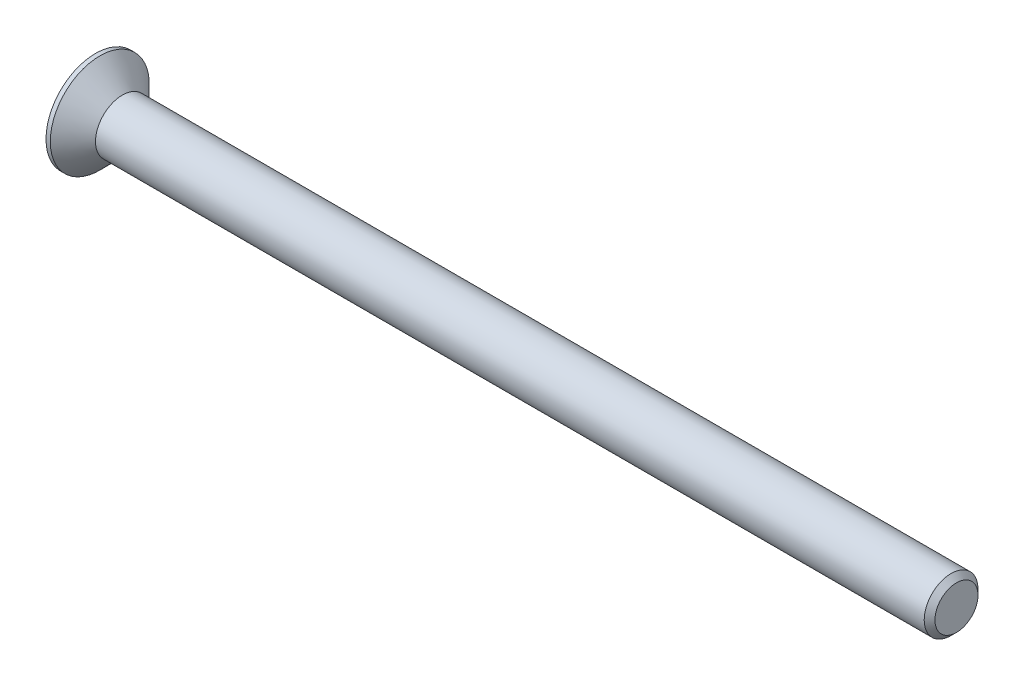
SolidWorks part; units mm, degrees
ref_plane "Front Plane" through (0, 0, 0) normal (0, 0, 1) x (1, 0, 0)
ref_plane "Top Plane" through (0, 0, 0) normal (0, 1, 0) x (1, 0, 0)
ref_plane "Right Plane" through (0, 0, 0) normal (1, 0, 0) x (0, 0, -1)
sketch "Sketch1" plane through (0, 0, 0) normal (0, 0, 1) x (1, 0, 0)
  line L1 (-2.5, 4.6) -> (-2.5, 0)
  line L2 (-2.5, 0) -> (77.5, 0)
  line L3 (77.5, 0) -> (77.5, 2.5)
  line L4 (77.5, 2.5) -> (0, 2.5)
  line L5 (-2.5, 4.6) -> (-2.1, 4.6)
  line L6 (-2.1, 4.6) -> (0, 2.5)
  dimension "D1" = 2.5
  dimension "D2" = 45
  dimension "D3" = 2.5
  dimension "D4" = 80
  dimension "D5" = 4.6
revolve "Revolve1" add sketch "Sketch1" angle 360 about L2
chamfer "Chamfer1" distance 0.5 angle 45 1 edges at (77.5, 0, 2.5)
sketch "Sketch2" plane through (-2.5, 0, 0) normal (-1, 0, 0) x (0, 0, 1)
  line L0 (-0.575, 2.3) -> (0.575, 2.3)
  line L1 (0.575, 2.3) -> (0.575, 0.575)
  line L2 (0.575, 0.575) -> (2.3, 0.575)
  line L3 (2.3, 0.575) -> (2.3, -0.575)
  line L4 (2.3, -0.575) -> (0.575, -0.575)
  line L5 (0.575, -0.575) -> (0.575, -2.3)
  line L6 (0.575, -2.3) -> (-0.575, -2.3)
  line L7 (-0.575, -2.3) -> (-0.575, -0.575)
  line L8 (-0.575, -0.575) -> (-2.3, -0.575)
  line L9 (-2.3, -0.575) -> (-2.3, 0.575)
  line L10 (-2.3, 0.575) -> (-0.575, 0.575)
  line L11 (-0.575, 0.575) -> (-0.575, 2.3)
  point P2 (0, 2.3)
  point P14 (0, -2.3)
  point P15 (2.3, 0)
  point P16 (-2.3, 0)
  dimension "D1" = 4.6
  dimension "D2" = 1.15
extrude "Cut-Extrude1" cut sketch "Sketch2" against normal blind 2.1
